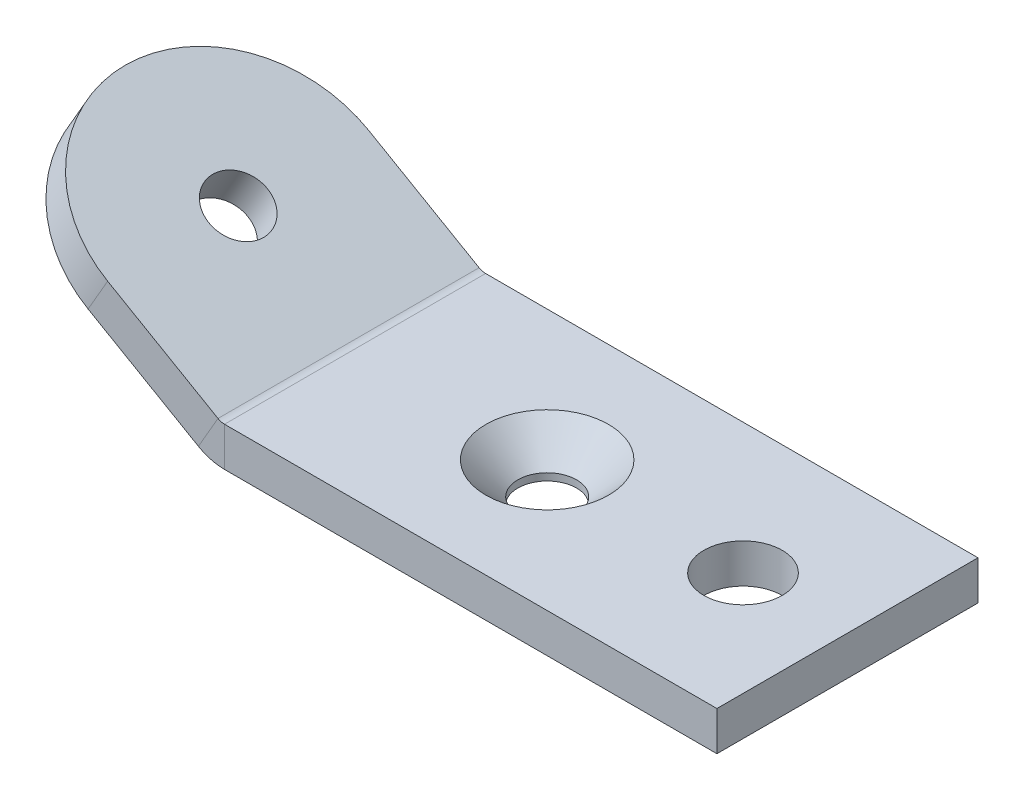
SolidWorks part; units mm, degrees
ref_plane "Front Plane" through (0, 0, 0) normal (0, 0, 1) x (1, 0, 0)
ref_plane "Top Plane" through (0, 0, 0) normal (0, 1, 0) x (1, 0, 0)
ref_plane "Right Plane" through (0, 0, 0) normal (1, 0, 0) x (0, 0, -1)
sketch "Sketch1" plane through (0, 0, 0) normal (0, 1, 0) x (1, 0, 0)
  line L0 (0, 0) -> (0, 20)
  line L1 (0, 20) -> (-48, 20)
  line L2 (0, 0) -> (-48, 0)
  line L3 (-48, 20) -> (-48, 0) construction
  line L4 (0, 10) -> (-48, 10) construction
  arc A0 (-48, 20) -> (-48, 0) centre (-48, 10) ccw
  circle A1 centre (-8, 10) radius 3
  circle A2 centre (-48, 10) radius 2.25
  dimension "D1" = 10
  dimension "D3" = 6
  dimension "D4" = 8
  dimension "D5" = 4.5
  dimension "D2" = 48
sheet metal parameters "Sheet-Metal1" thickness 3 parameters "D1"=1
base flange "Base-Flange1" sketch "Sketch1" thickness 3 reverse thickness direction yes parameters "D1"=1
sketch "Sketch3" plane through (0, 3, 0) normal (0, 1, 0) x (1, 0, 0)
  line L0 (0, 10) -> (-48, 10) construction
  line L1 (0, 0) -> (0, 20) construction
  circle A0 centre (-8, 10) radius 3 construction
  point P5 (-23, 10)
  dimension "D1" = 15
hole_wizard "CSK for M4 Countersunk Flat Head Screw1" positions "3DSketch1" profile "Sketch4" countersink size "M4" standard "ISO"
sketch3d "3DSketch1"
  point P0 (-23, 3, -10)
sketch "Sketch4" plane through (-23, 3, -10) normal (1, 0, 0) x (0, 0, 1)
  line L0 (0, 0) -> (0, 3)
  line L1 (0, 3) -> (2.25, 3)
  line L2 (2.25, 3) -> (2.25, 2.45)
  line L3 (2.25, 2.45) -> (4.7, 0)
  line L5 (4.7, 0) -> (0, 0)
  line L6 (-2.25, 2.45) -> (-4.7, 0) construction
  line L11 (0, -6.35) -> (0, 107.95) construction
  dimension "Thru Hole Dia." = 4.5
  dimension "Thru Hole Depth" = 3
  dimension "Near C'Sink Dia." = 9.4
  dimension "Near C'Sink Angle" = 90
sketch "Sketch5" plane through (0, 3, 0) normal (0, 1, 0) x (1, 0, 0)
  line L0 (-37.9794, 20) -> (-37.9794, 0)
  line L1 (0, 20) -> (-48, 20) construction
  line L2 (-48, 0) -> (0, 0) construction
sketched bend "Sketched Bend1" parameters "D1"=1
bend "SketchBend1" bend radius 1 bend angle 30 parameters "D5"=1
flat pattern "Flat-Pattern1"
sketch "Bend-Lines1" plane through (0, 0, 0) normal (0, 1, 0) x (-1, 0, 0)
bend of the flat pattern "Flatten-<SketchBend1>1"
